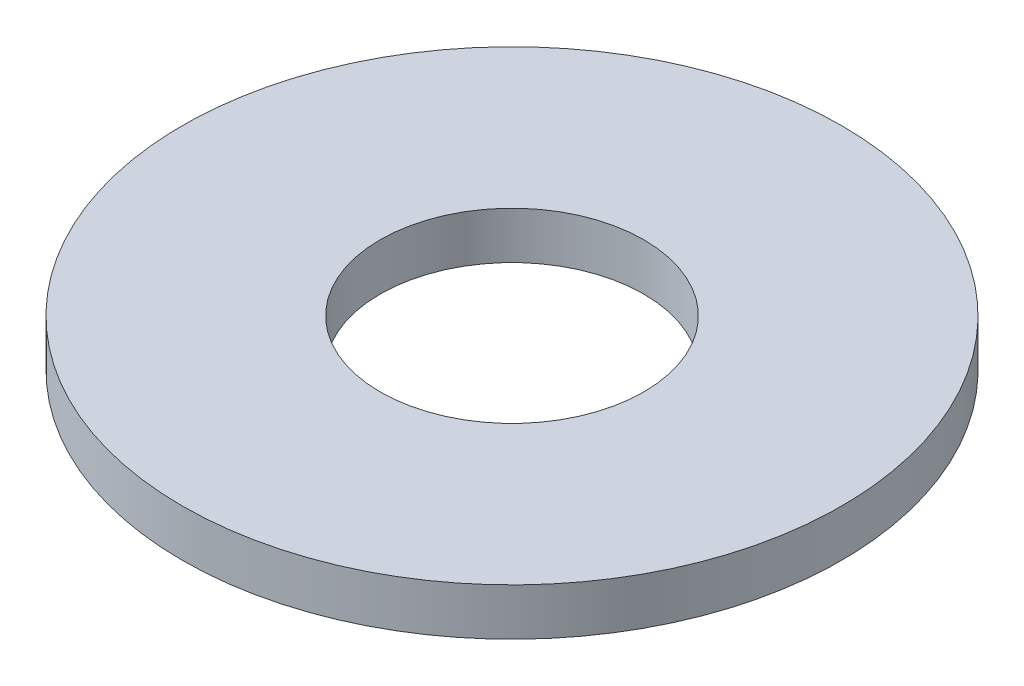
SolidWorks part; units mm, degrees
ref_plane "Front" through (0, 0, 0) normal (0, 0, 1) x (1, 0, 0)
ref_plane "Top" through (0, 0, 0) normal (0, 1, 0) x (1, 0, 0)
ref_plane "Right" through (0, 0, 0) normal (1, 0, 0) x (0, 0, -1)
sketch "Sketch1" plane through (0, 0, 0) normal (0, 1, 0) x (1, 0, 0)
  circle A0 centre (0, 0) radius 1.4
  circle A1 centre (0, 0) radius 3.5
extrude "Extrude1" add sketch "Sketch1" along normal blind 0.5
